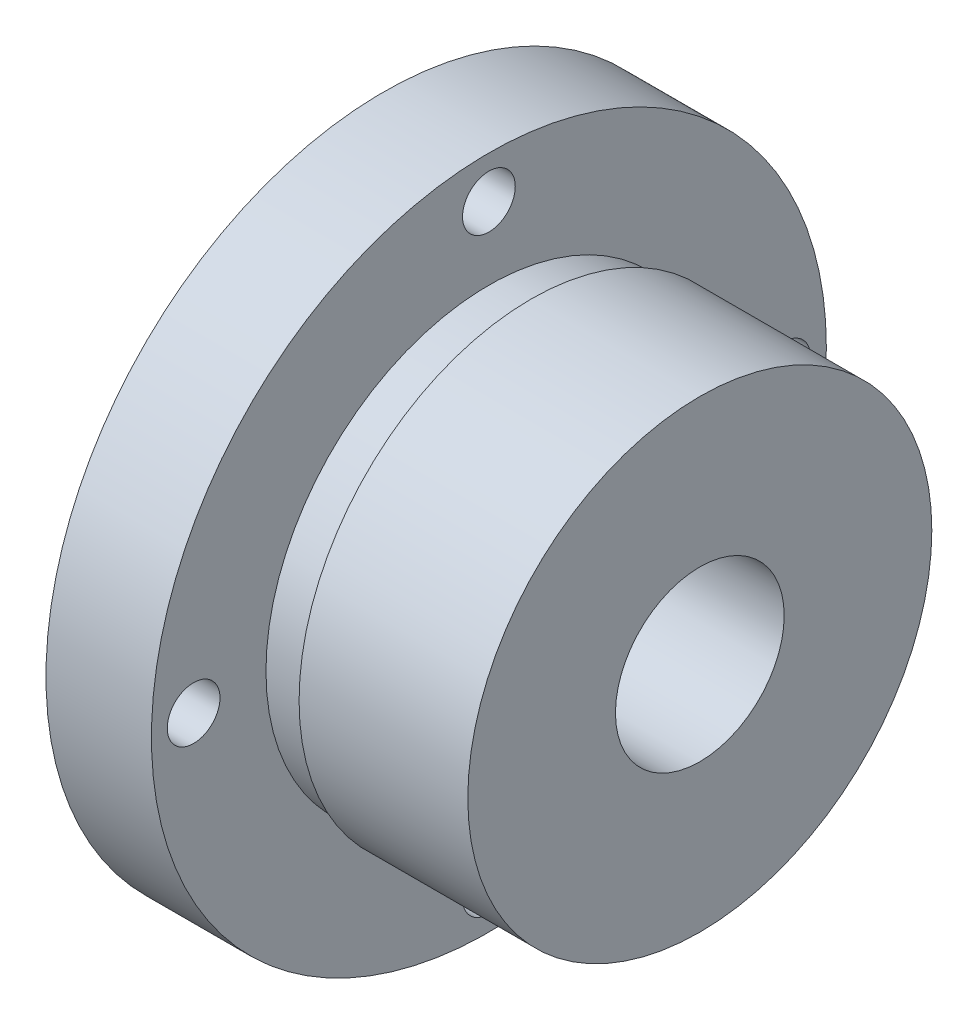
SolidWorks part; units mm, degrees
ref_plane "前视基准面" through (0, 0, 0) normal (0, 0, 1) x (1, 0, 0)
ref_plane "上视基准面" through (0, 0, 0) normal (0, 1, 0) x (1, 0, 0)
ref_plane "右视基准面" through (0, 0, 0) normal (1, 0, 0) x (0, 0, -1)
sketch "草图1" plane through (0, 0, 0) normal (0, 0, 1) x (1, 0, 0)
  line L0 (0, 0) -> (0, 16)
  line L1 (0, 16) -> (5, 16)
  line L2 (5, 16) -> (5, 10.57)
  line L3 (5, 10.57) -> (7, 10.57)
  line L4 (7, 10.57) -> (7, 11)
  line L5 (7, 11) -> (15, 11)
  line L6 (15, 11) -> (15, 0)
  line L7 (15, 0) -> (0, 0)
revolve "旋转1" add sketch "草图1" angle 360 about L7
sketch "草图3" plane through (0, 0, 0) normal (-1, 0, 0) x (0, 0, 1)
  point P0 (14, 0)
  point P5 (0, -14)
  point P6 (-14, 0)
  point P7 (0, 14)
hole_wizard "M3 螺纹孔1" positions "3D草图1" profile "草图4" tap size "M3" standard "GB"
sketch3d "3D草图1"
  point P0 (0, 0, -14)
  point P3 (0, 14, 0)
  point P6 (0, 0, 14)
  point P9 (0, -14, 0)
sketch "草图4" plane through (0, 0, -14) normal (0, 1, 0) x (0, 0, 1)
  line L0 (0, 0) -> (0, 5)
  line L1 (0, 5) -> (1.25, 5)
  line L2 (1.25, 5) -> (1.25, 0)
  line L5 (1.25, 0) -> (0, 0)
  line L11 (0, -6.35) -> (0, 107.95) construction
  dimension "籵謂蹟恇謂郰芛眻噤" = 2.5
  dimension "籵謂蹟恇謂郰芛旮僅" = 5
sketch "草图5" plane through (0, 0, 0) normal (-1, 0, 0) x (0, 0, 1)
  circle A0 centre (0, 0) radius 4
extrude "切除-拉伸1" cut sketch "草图5" against normal up to next
